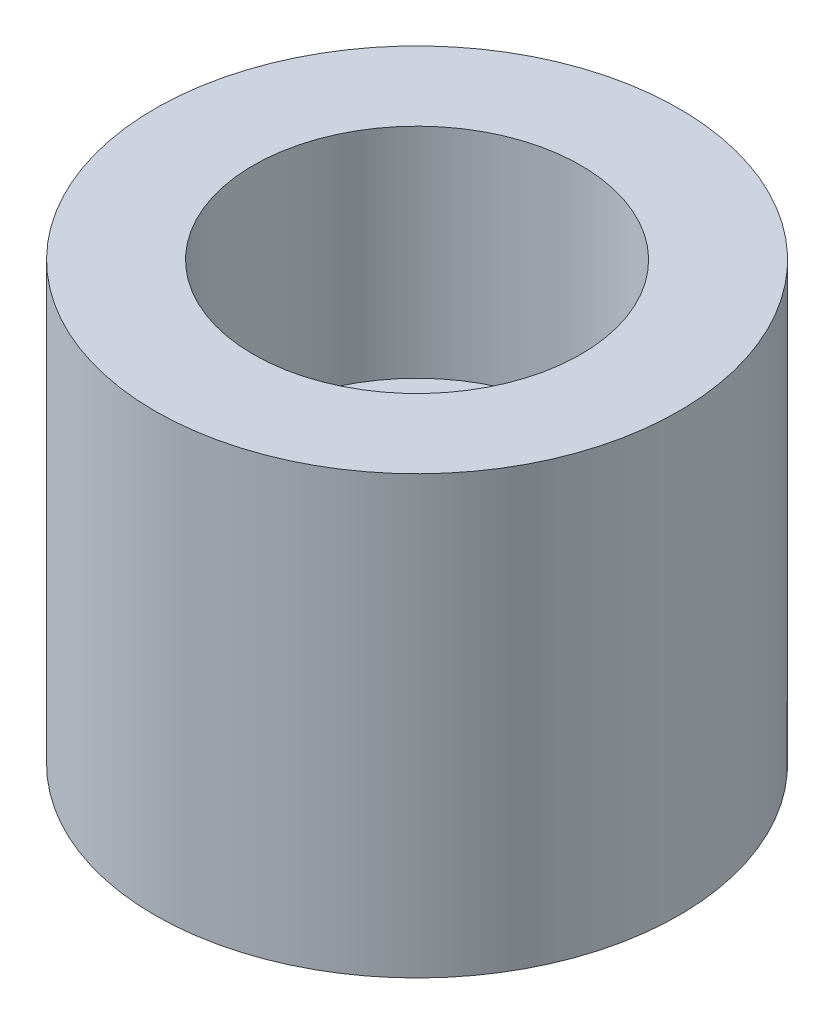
SolidWorks part; units mm, degrees
ref_plane "Front Plane" through (0, 0, 0) normal (0, 0, 1) x (1, 0, 0)
ref_plane "Top Plane" through (0, 0, 0) normal (0, 1, 0) x (1, 0, 0)
ref_plane "Right Plane" through (0, 0, 0) normal (1, 0, 0) x (0, 0, -1)
sketch "Sketch1" plane through (0, 0, 0) normal (0, 1, 0) x (1, 0, 0)
  circle A0 centre (0, 0) radius 60
  dimension "D1" = 120
extrude "Extrude1" add sketch "Sketch1" along normal blind 100
other "Hole1" parameters "D1"=50
sketch "Sketch2" plane through (0, 100, 0) normal (0, 1, 0) x (-1, 0, 0)
  circle A0 centre (0, 0) radius 37.5
  dimension "D1" = 75
